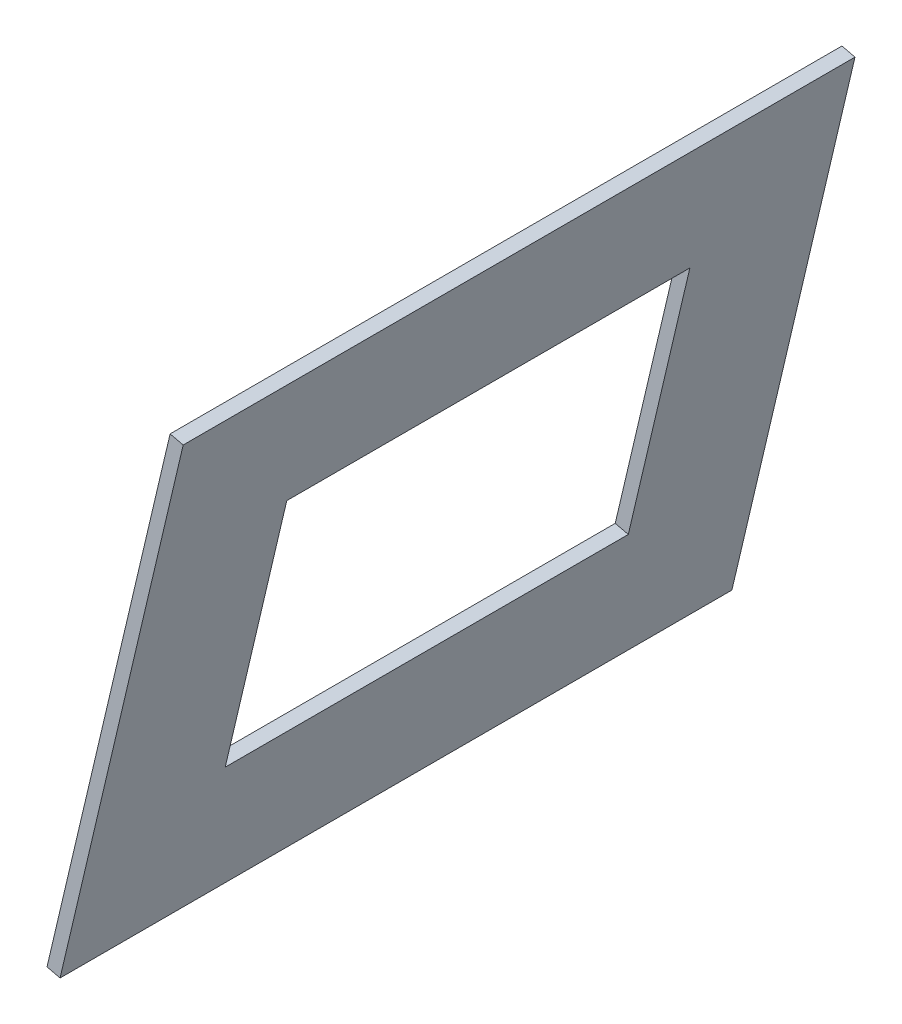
SolidWorks part; units mm, degrees
ref_plane "Alzado" through (0, 0, 0) normal (0, 0, 1) x (1, 0, 0)
ref_plane "Planta" through (0, 0, 0) normal (0, 1, 0) x (1, 0, 0)
ref_plane "Vista lateral" through (0, 0, 0) normal (1, 0, 0) x (0, 0, -1)
sketch "Croquis1" plane through (0, 0, 0) normal (0, 0, 1) x (1, 0, 0)
  line L0 (-238.2198, 152.7858) -> (-228.4857, 150.495)
  line L1 (-238.2198, 152.7858) -> (-146.5898, 542.1493)
  line L2 (-228.4857, 150.495) -> (-136.8557, 539.8585)
  line L3 (-146.5898, 542.1493) -> (-136.8557, 539.8585)
  arc A0 (-275.4495, 165.5551) -> (-216.7148, 567.1757) centre (-587.1465, 416.2441) ccw construction
  point P0 (-118.8137, 531.5626)
  dimension "D1" = 10
  dimension "D2" = 400
extrude "Saliente-Extruir1" add sketch "Croquis1" against normal up to surface (565.8128 mm away)
ref_plane "Plano1" through (0, 0, 250) normal (0, 0, 1) x (1, 0, 0)
sketch "Croquis3" plane through (-259.7879, 61.1366, 0) normal (-0.9734, 0.2291, 0) x (0, 0, 1)
  line L0 (0, 494.1528) -> (500, 94.1528) construction
  line L1 (500, 494.1528) -> (0, 94.1528) construction
  line L3 (400, 194.1528) -> (100, 194.1528)
  line L4 (400, 194.1528) -> (400, 394.1528)
  line L5 (400, 394.1528) -> (100, 394.1528)
  line L6 (100, 194.1528) -> (100, 394.1528)
  line L7 (400, 194.1528) -> (100, 394.1528) construction
  line L8 (400, 394.1528) -> (100, 194.1528) construction
  point P8 (250, 294.1528)
  dimension "D1" = 300
  dimension "D2" = 200
extrude "Cortar-Extruir1" cut sketch "Croquis3" against normal through all both and the other way through all
